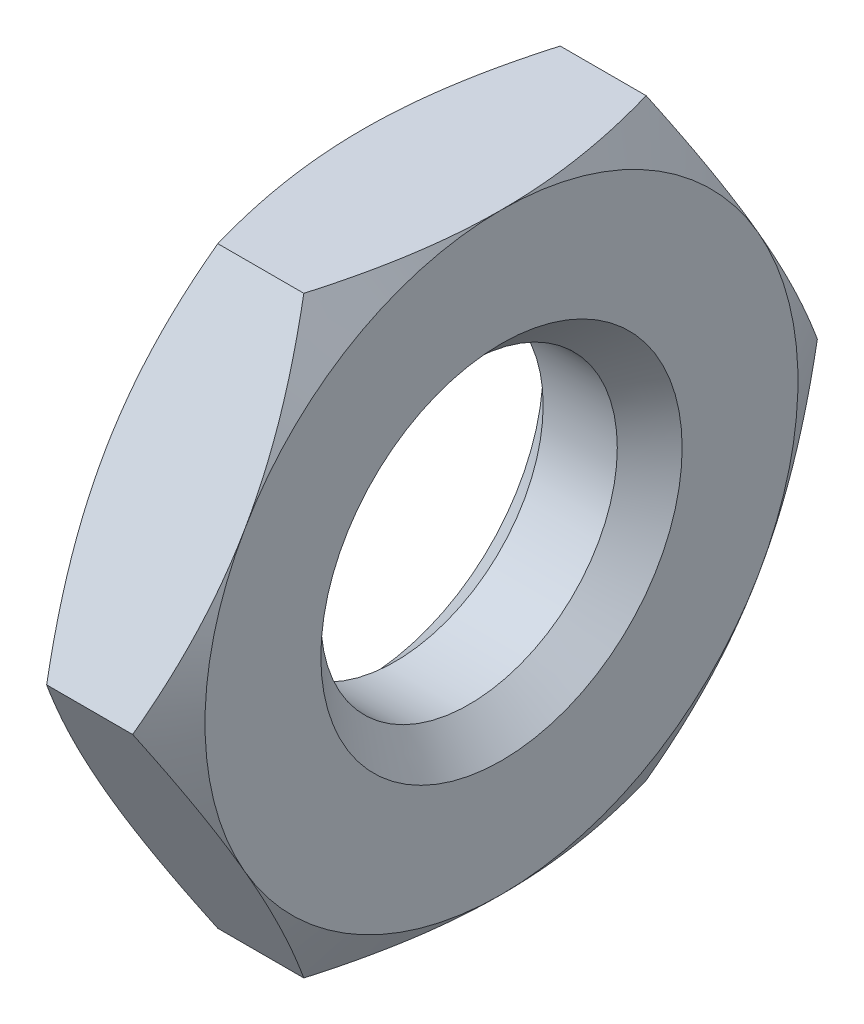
SolidWorks part; units mm, degrees
ref_plane "Front Plane" through (0, 0, 0) normal (0, 0, 1) x (1, 0, 0)
ref_plane "Top Plane" through (0, 0, 0) normal (0, 1, 0) x (1, 0, 0)
ref_plane "Right Plane" through (0, 0, 0) normal (1, 0, 0) x (0, 0, -1)
sketch "Sketch1" plane through (0, 0, 0) normal (1, 0, 0) x (0, 0, -1)
  line L1 (0.9238, 1.6) -> (-0.9238, 1.6)
  line L2 (-0.9238, 1.6) -> (-1.8475, 0)
  line L3 (-1.8475, 0) -> (-0.9238, -1.6)
  line L4 (-0.9238, -1.6) -> (0.9238, -1.6)
  line L5 (0.9238, -1.6) -> (1.8475, 0)
  line L6 (1.8475, 0) -> (0.9238, 1.6)
  circle A0 centre (0, 0) radius 1.6 construction
  circle A1 centre (0, 0) radius 0.8
extrude "Extrude1" add sketch "Sketch1" along normal blind 0.75
sketch "Sketch2" plane through (0, 0, 0) normal (0, 0, 1) x (1, 0, 0)
  line L0 (0.75, 1.6) -> (0.75, 6.4)
  line L1 (0.75, 6.4) -> (0, 6.4)
  line L2 (0, 6.4) -> (0, 1.6)
  line L3 (0, 1.6) -> (0.375, 2.2495)
  line L4 (0.375, 2.2495) -> (0.75, 1.6)
revolve "Cut-Revolve1" cut sketch "Sketch2" angle 360 about axis through (0.75, 0, 0) along (-1, 0, 0)
chamfer "Chamfer1" distance 0.175 angle 45 2 edges at (0, 0, -0.8) (0.75, 0, -0.8)
equation "\"D2@Sketch2\"=\"D1@Sketch1\"*2"
